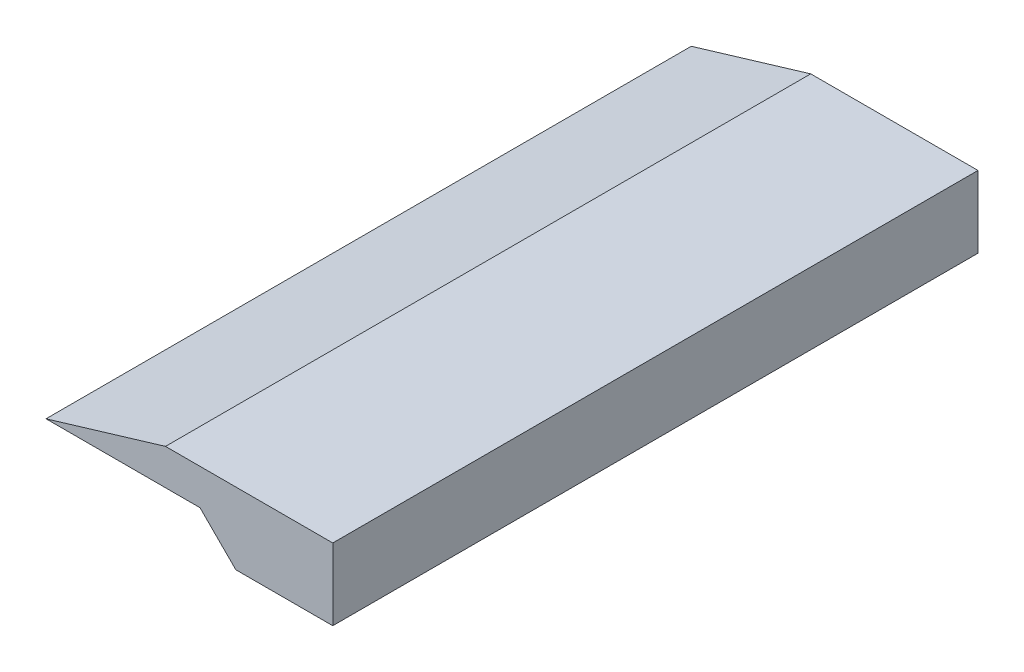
SolidWorks part; units mm, degrees
ref_plane "Plane1" through (0, 0, 0) normal (0, 0, 1) x (1, 0, 0)
ref_plane "Plane2" through (0, 0, 0) normal (0, 1, 0) x (1, 0, 0)
ref_plane "Plane3" through (0, 0, 0) normal (1, 0, 0) x (0, 0, -1)
sketch "Sketch2" plane through (0, 0, 0) normal (0, 0, 1) x (1, 0, 0)
  line L0 (-212.13, 1.5) -> (-219.13, 1.5)
  line L1 (-219.13, 1.5) -> (-224.13, 0)
  line L2 (-224.13, 0) -> (-219.13, -1.5)
  line L3 (-219.13, -1.5) -> (-212.13, -1.5)
  line L4 (-206.33, 0) -> (-224.13, 0) construction
  line L6 (-212.13, 1.5) -> (-212.13, -1.5)
  dimension "D1" = 12
  dimension "D3" = 3
  dimension "D4" = 7
extrude "Base-Extrude" add sketch "Sketch2" against normal blind 27
sketch "Sketch3" plane through (0, 0, 0) normal (0, 0, 1) x (1, 0, 0)
  line L0 (-224.13, 0) -> (-217.6867, 0)
  line L1 (-217.6867, 0) -> (-216.1867, -1.5)
  line L2 (-216.1867, -1.5) -> (-224.13, -1.5)
  line L3 (-224.13, -1.5) -> (-224.13, 0)
  line L4 (-219.13, -1.5) -> (-212.13, -1.5) construction
  dimension "D1" = 6.4433
  dimension "D2" = 45
extrude "Cut-Extrude1" cut sketch "Sketch3" against normal through all
